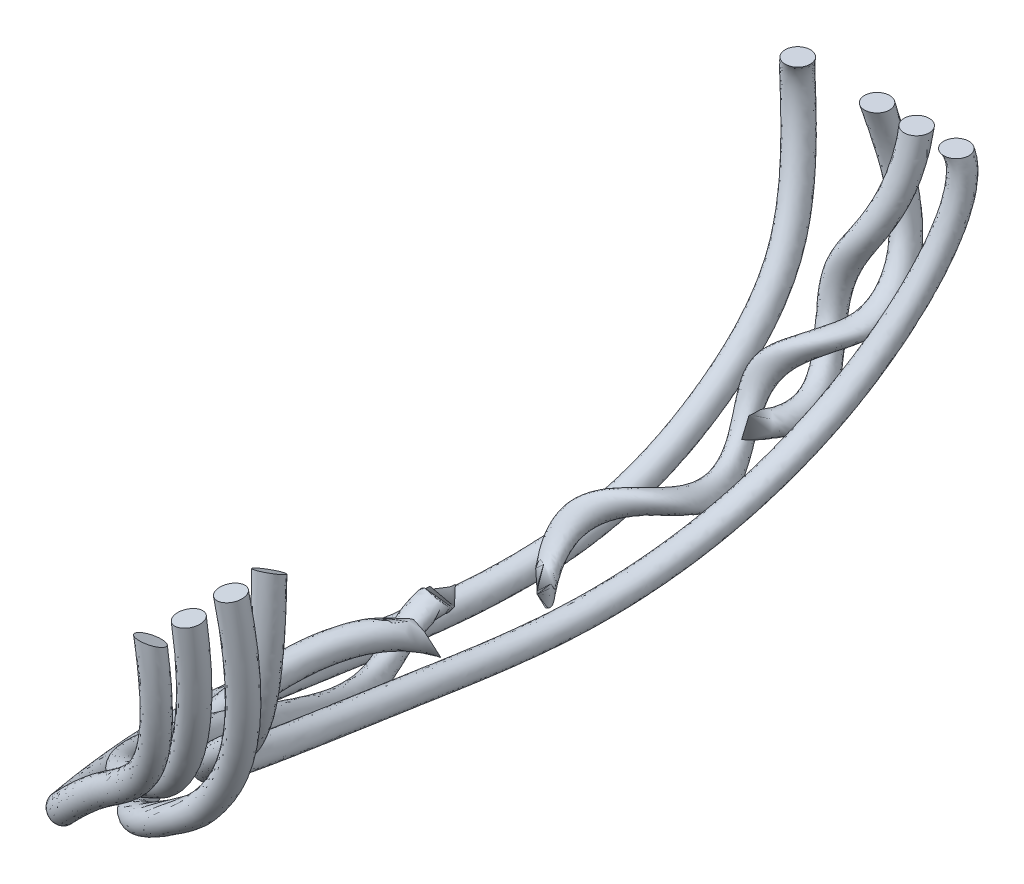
SolidWorks part; units mm, degrees
ref_plane "Front Plane" through (0, 0, 0) normal (0, 0, 1) x (1, 0, 0)
ref_plane "Top Plane" through (0, 0, 0) normal (0, 1, 0) x (1, 0, 0)
ref_plane "Right Plane" through (0, 0, 0) normal (1, 0, 0) x (0, 0, -1)
sketch "Sketch1" plane through (0, -20.01, 0) normal (0, -1, 0) x (-1, 0, 0)
  line L0 (60.35, 81.69) -> (60.35, 79.27) construction
  line L1 (60.7, 81.69) -> (60, 81.69) construction
  line L2 (60.99, 79.27) -> (59.71, 79.27) construction
  line L3 (60.04, 80.16) -> (60.66, 80.16) construction
  line L4 (64.35, 80.16) -> (62.35, 80.16) construction
  circle A0 centre (60.35, 80.16) radius 0.635
  circle A1 centre (62.35, 80.16) radius 0.635
  circle A2 centre (64.35, 80.16) radius 0.635
  circle A4 centre (68.35, 80.16) radius 0.635
  circle A5 centre (66.35, 80.16) radius 0.635
  point P8 (63.35, 80.16)
  dimension "D1" = 1.27
  dimension "D3" = 2
  dimension "D2" = 5
sketch "Sketch2" plane through (0, -16.5352, 0) normal (0, -1, 0) x (-1, 0, 0)
  line L0 (55.7275, 41.1685) -> (55.7275, 34.5685) construction
  line L1 (55.4275, 41.1685) -> (56.0275, 41.1685) construction
  line L2 (56.0275, 34.5685) -> (55.4275, 34.5685) construction
  line L3 (56.0275, 40.8685) -> (55.4275, 40.8685) construction
  line L4 (56.0275, 41.1685) -> (56.0275, 40.5685) construction
  line L5 (55.4275, 40.5685) -> (55.4275, 41.1685) construction
  line L6 (56.0275, 38.8685) -> (55.4275, 38.8685) construction
  line L7 (56.0275, 39.1685) -> (56.0275, 38.5685) construction
  line L8 (55.4275, 38.5685) -> (55.4275, 39.1685) construction
  line L9 (56.0275, 36.8685) -> (55.4275, 36.8685) construction
  line L10 (56.0275, 37.1685) -> (56.0275, 36.5685) construction
  line L11 (55.4275, 36.5685) -> (55.4275, 37.1685) construction
  line L12 (56.0275, 34.8685) -> (55.4275, 34.8685) construction
  line L13 (56.0275, 35.1685) -> (56.0275, 34.5685) construction
  line L14 (55.4275, 34.5685) -> (55.4275, 35.1685) construction
  circle A0 centre (55.7275, 40.8685) radius 0.635
  circle A1 centre (55.7275, 38.8685) radius 0.635
  circle A2 centre (55.7275, 36.8685) radius 0.635
  circle A3 centre (55.7275, 34.8685) radius 0.635
  point P39 (55.7275, 37.8685)
  dimension "D1" = 1.27
sketch3d "3DSketch1"
  line L2 (-56.0275, -16.5352, -40.8685) -> (-55.4275, -16.5352, -40.8685) construction
  spline S0 degree 3 poles (-60.35, -20.01, -80.16) (-59.6935, -21.754, -80.7691) (-62.0724, -30.8578, -77.0683) (-63.1922, -34.4285, -66.0909) (-64.715, -34.0148, -55.2125) (-64.5181, -32.4381, -45.1725) (-58.2994, -25.7034, -41.2605) (-55.5007, -23.6429, -40.5362) (-55.7275, -16.5352, -40.8685) knots 0 0 0 0 0.208325 0.399407 0.528304 0.748573 0.857119 1 1 1 1
sketch "Sketch3" plane through (0, -20.01, 0) normal (0, -1, 0) x (-1, 0, 0)
  circle A0 centre (60.35, 80.16) radius 0.635 construction
  circle A1 centre (60.35, 80.16) radius 0.635
sweep "Sweep1" add profiles "Sketch3" path "3DSketch1"
sketch3d "3DSketch2"
  spline S0 degree 3 poles (-63.35, -20.01, -80.16) (-63.5032, -25.7434, -80.6777) (-63.8656, -29.1816, -76.8907) (-64.688, -31.6545, -73.3681) (-66.0764, -33.9553, -65.7642) (-66.2178, -34.1174, -62.9263) (-66.6638, -34.0534, -57.7949) (-66.8057, -33.4159, -52.4723) (-65.5849, -31.8011, -45.088) (-63.8916, -30.6987, -39.9742) (-55.1976, -24.7511, -38.839) (-55.7275, -16.5352, -37.8685) knots 0 0 0 0 0.161664 0.321205 0.428435 0.724911 0.804133 0.865205 0.902263 0.963912 1 1 1 1
sketch "Sketch4" plane through (0, -20.01, 0) normal (0, -1, 0) x (-1, 0, 0)
  circle A0 centre (64.35, 80.16) radius 0.635 construction
  circle A1 centre (62.35, 80.16) radius 0.635 construction
  circle A2 centre (64.35, 80.16) radius 0.635
  circle A3 centre (62.35, 80.16) radius 0.635
sweep "Sweep2" add profiles "Sketch4" path "3DSketch2" parameters "D4"=1461.6
sketch3d "3DSketch3"
  spline S0 degree 3 poles (-68.35, -20.01, -80.16) (-68.9453, -21.3721, -80.6117) (-66.932, -26.5361, -79.5764) (-67.2283, -33.4013, -73.1902) (-68.5152, -36.7042, -64.6883) (-71.0745, -35.5659, -52.579) (-64.6419, -30.9346, -37.7513) (-62.217, -27.8716, -38.0286) (-57.5435, -24.4494, -36.1543) (-55.2785, -21.2281, -35.1605) (-55.7275, -16.5352, -34.8685) knots 0 0 0 0 0.106098 0.175332 0.333815 0.566226 0.683861 0.840224 0.898951 1 1 1 1
sketch "Sketch5" plane through (0, -20.01, 0) normal (0, -1, 0) x (-1, 0, 0)
  circle A0 centre (68.35, 80.16) radius 0.635 construction
  circle A1 centre (68.35, 80.16) radius 0.635
sweep "Sweep3" add profiles "Sketch5" path "3DSketch3"
